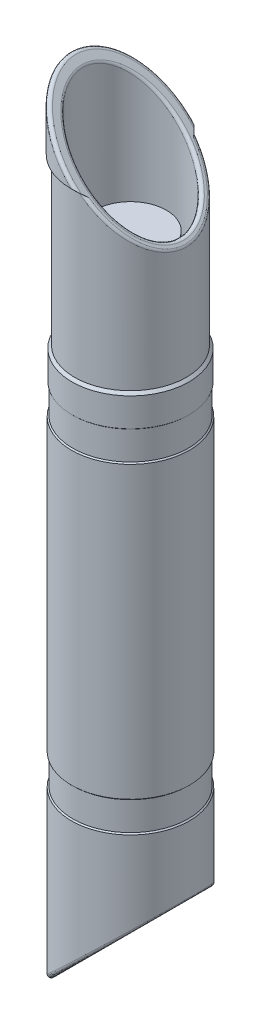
SolidWorks part; units mm, degrees
ref_plane "Front Plane" through (0, 0, 0) normal (0, 0, 1) x (1, 0, 0)
ref_plane "Top Plane" through (0, 0, 0) normal (0, 1, 0) x (1, 0, 0)
ref_plane "Right Plane" through (0, 0, 0) normal (1, 0, 0) x (0, 0, -1)
sketch "Sketch1" plane through (0, 0, 0) normal (0, 0, 1) x (1, 0, 0)
  line L0 (-25.527, 426.085) -> (-25.527, 324.485)
  line L1 (-25.527, 324.485) -> (-19.177, 324.485)
  line L2 (-19.177, 324.485) -> (-19.177, 356.235)
  line L3 (-19.177, 356.235) -> (0, 356.235)
  line L4 (-25.527, 0) -> (-25.527, 63.5)
  line L5 (-25.527, 63.5) -> (0, 63.5)
  line L17 (-25.527, 426.085) -> (-31.877, 426.085)
  line L18 (-31.877, 426.085) -> (-31.877, 391.795)
  line L20 (-31.877, 391.795) -> (-29.845, 389.763)
  line L21 (-29.845, 389.763) -> (-29.845, 303.403)
  line L22 (-29.845, 303.403) -> (-31.242, 302.006)
  line L23 (-31.242, 302.006) -> (-31.242, 286.766)
  line L24 (-31.242, 286.766) -> (-30.861, 286.385)
  line L25 (-30.861, 286.385) -> (-30.861, 271.145)
  line L26 (-30.861, 271.145) -> (-31.496, 270.51)
  line L27 (-31.496, 270.51) -> (-31.496, 115.57)
  line L28 (-31.496, 115.57) -> (-30.861, 114.935)
  line L29 (-30.861, 114.935) -> (-30.861, 99.695)
  line L30 (-30.861, 99.695) -> (-31.496, 99.06)
  line L31 (-31.496, 99.06) -> (-31.496, 0)
  line L32 (-31.496, 0) -> (-25.527, 0)
  line L33 (0, 356.235) -> (0, 63.5)
  line L34 (0, 426.085) -> (0, 709.8923) construction
  dimension "D4" = 62.484
  dimension "D5" = 61.722
  dimension "D6" = 6.35
  dimension "D7" = 6.35
  dimension "D8" = 31.75
  dimension "D9" = 101.6
  dimension "D10" = 63.5
  dimension "D19" = 34.29
  dimension "D20" = 2.032
  dimension "D21" = 45
  dimension "D22" = 59.69
  dimension "D23" = 45
  dimension "D24" = 86.36
  dimension "D25" = 15.24
  dimension "D26" = 15.24
  dimension "D27" = 45
  dimension "D28" = 45
  dimension "D29" = 62.992
  dimension "D30" = 154.94
  dimension "D31" = 45
  dimension "D32" = 45
  dimension "D33" = 15.24
  dimension "D34" = 99.06
revolve "Revolve10" add sketch "Sketch1" angle 360 about L34
sketch "Sketch2" plane through (0, 0, 0) normal (0, 0, 1) x (1, 0, 0)
  line L0 (-31.877, 426.085) -> (55.7559, 338.4521)
  line L1 (31.877, 426.085) -> (-31.877, 426.085) construction
  line L2 (55.7559, 338.4521) -> (55.7559, 426.085)
  line L3 (55.7559, 426.085) -> (-31.877, 426.085)
  line L4 (-31.496, 0) -> (39.0998, 70.5958)
  line L5 (39.0998, 70.5958) -> (39.0998, 0)
  line L6 (39.0998, 0) -> (-31.496, 0)
  dimension "D1" = 45
  dimension "D2" = 45
extrude "Cut-Extrude1" cut sketch "Sketch2" against normal through all both and the other way through all
fillet "Fillet1" radius 1.5875 5 edges at (-25.527, 5.969, 0) (-31.496, 0, 0) (-31.877, 426.085, 0) (25.527, 368.681, 0) (29.845, 364.363, 0)
